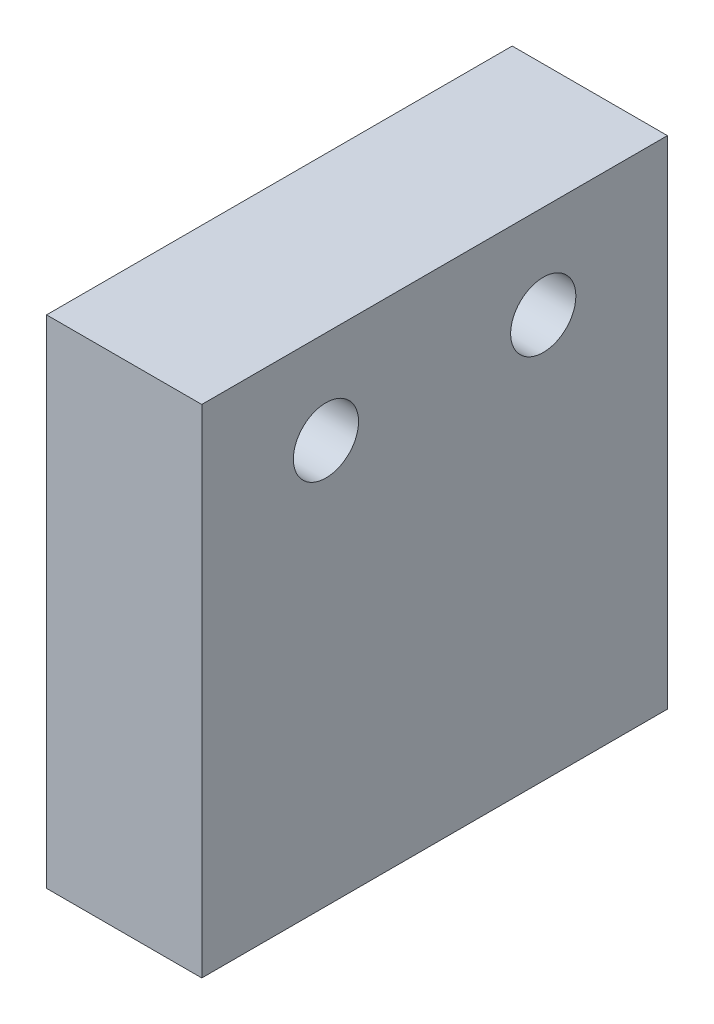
SolidWorks part; units mm, degrees
ref_plane "前视基准面" through (0, 0, 0) normal (0, 0, 1) x (1, 0, 0)
ref_plane "上视基准面" through (0, 0, 0) normal (0, 1, 0) x (1, 0, 0)
ref_plane "右视基准面" through (0, 0, 0) normal (1, 0, 0) x (0, 0, -1)
sketch "草图1" plane through (0, 0, 0) normal (0, 0, 1) x (1, 0, 0)
  line L0 (10, 0) -> (10, 32)
  line L1 (0, 0) -> (0, 32)
  line L2 (0, 0) -> (10, 0)
  line L3 (0, 32) -> (10, 32)
extrude "凸台-拉伸1" add sketch "草图1" along normal blind 30
sketch "草图2" plane through (10, 0, 0) normal (1, 0, 0) x (0, 0, -1)
  circle A0 centre (-22, 26) radius 2.1
  circle A1 centre (-8, 26) radius 2.1
extrude "切除-拉伸1" cut sketch "草图2" against normal blind 30
sketch "草图3" plane through (0, 32, 0) normal (0, 1, 0) x (1, 0, 0)
  circle A0 centre (5, -5) radius 2.5
  circle A1 centre (5, -25) radius 2.5
sketch "草图4" plane through (0, 0, 0) normal (0, -1, 0) x (1, 0, 0)
  circle A0 centre (5, 25) radius 2.5
  circle A1 centre (5, 5) radius 2.5
extrude "切除-拉伸2" cut sketch "草图4" against normal blind 12
